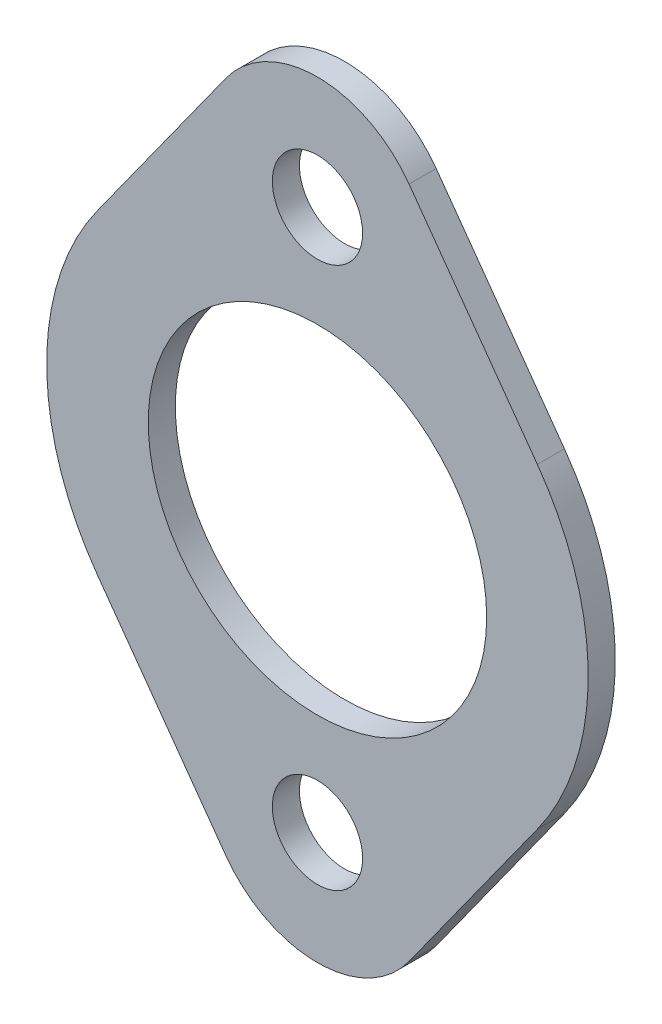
SolidWorks part; units mm, degrees
ref_plane "Front" through (0, 0, 0) normal (0, 0, 1) x (1, 0, 0)
ref_plane "Top" through (0, 0, 0) normal (0, 1, 0) x (1, 0, 0)
ref_plane "Right" through (0, 0, 0) normal (1, 0, 0) x (0, 0, -1)
sketch "Sketch1" plane through (0, 0, 0) normal (0, 0, 1) x (1, 0, 0)
  line L0 (0, 0) -> (0, 94.4945) construction
  line L1 (0, 0) -> (88.837, 0) construction
  line L2 (12.8942, 47.3604) -> (30.9461, 22.225)
  line L3 (12.8942, -47.3604) -> (30.9461, -22.225)
  line L4 (-12.8942, 47.3604) -> (-30.9461, 22.225)
  line L5 (-12.8942, -47.3604) -> (-30.9461, -22.225)
  arc A0 (-12.8942, 47.3604) -> (12.8942, 47.3604) centre (0, 38.1) cw
  arc A1 (-12.8942, -47.3604) -> (12.8942, -47.3604) centre (0, -38.1) ccw
  arc A2 (30.9461, 22.225) -> (30.9461, -22.225) centre (0, 0) cw
  arc A3 (-30.9461, -22.225) -> (-30.9461, 22.225) centre (0, 0) cw
  dimension "EndR" = 15.875
  dimension "SideR" = 38.1
  dimension "CtoC" = 76.2
extrude "Main" add sketch "Sketch1" along normal blind 3.81
sketch "Sketch2" plane through (0, 0, 3.81) normal (0, 0, 1) x (1, 0, 0)
  circle A0 centre (0, 38.1) radius 6.35
  circle A1 centre (0, -38.1) radius 6.35
  circle A2 centre (0, 0) radius 23.8125
  dimension "BoltH" = 12.7
  dimension "CenterH" = 47.625
extrude "Holes" cut sketch "Sketch2" against normal through all
